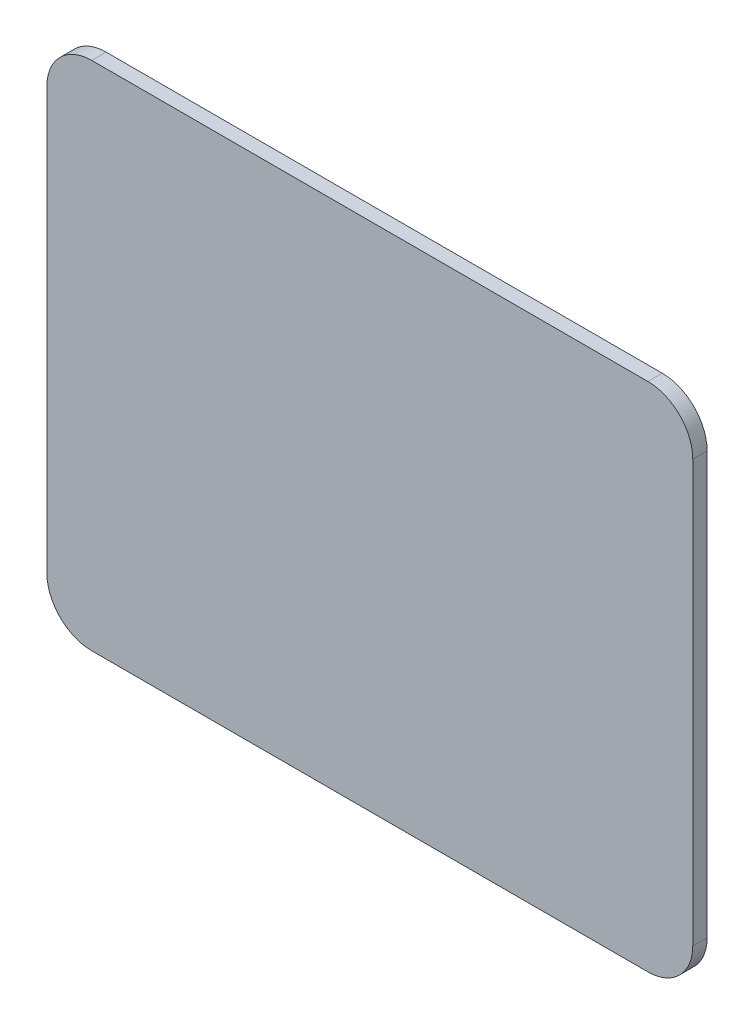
SolidWorks part; units mm, degrees
ref_plane "Face" through (0, 0, 0) normal (0, 0, 1) x (1, 0, 0)
ref_plane "Dessus" through (0, 0, 0) normal (0, 1, 0) x (1, 0, 0)
ref_plane "Côté" through (0, 0, 0) normal (1, 0, 0) x (0, 0, -1)
sketch "Esquisse1" plane through (0, 0, 0) normal (0, 0, 1) x (1, 0, 0)
  line L1 (-15.5, 28.5) -> (15.5, 28.5)
  line L2 (-18, 26) -> (-18, 2.5)
  line L3 (-15.5, 0) -> (15.5, 0)
  line L4 (18, 26) -> (18, 2.5)
  arc A0 (-18, 26) -> (-15.5, 28.5) centre (-15.5, 26) cw
  arc A1 (-15.5, 0) -> (-18, 2.5) centre (-15.5, 2.5) cw
  arc A2 (18, 2.5) -> (15.5, 0) centre (15.5, 2.5) cw
  arc A3 (18, 26) -> (15.5, 28.5) centre (15.5, 26) ccw
  point P9 (-18, 0)
  point P12 (18, 0)
  point P15 (18, 28.5)
  dimension "D3" = 2.5
  dimension "D1" = 36
  dimension "D2" = 28.5
extrude "Base-Extrusion" add sketch "Esquisse1" against normal blind 0.8
